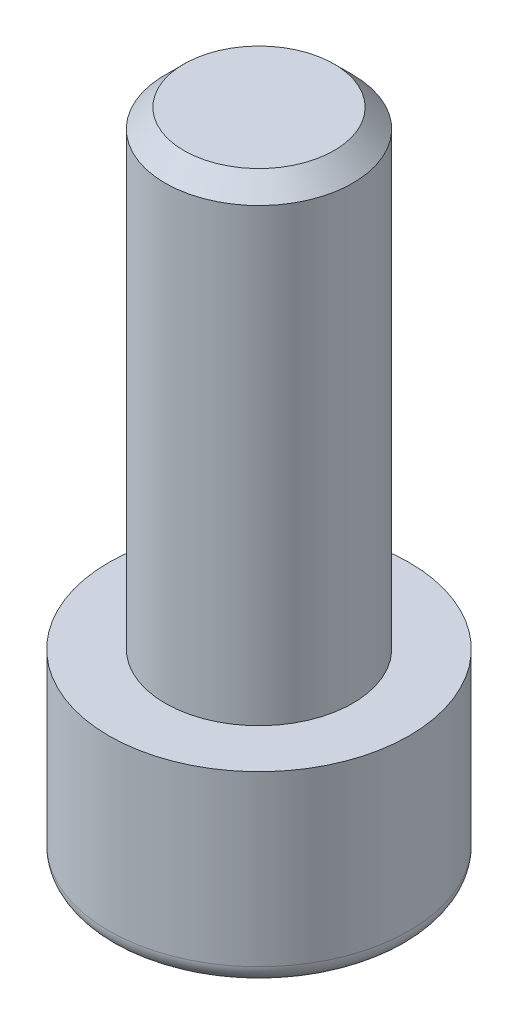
SolidWorks part; units mm, degrees
ref_plane "Plan de face" through (0, 0, 0) normal (0, 0, 1) x (1, 0, 0)
ref_plane "Plan de dessus" through (0, 0, 0) normal (0, 1, 0) x (1, 0, 0)
ref_plane "Plan de droite" through (0, 0, 0) normal (1, 0, 0) x (0, 0, -1)
sketch "Esquisse1" plane through (0, 0, 0) normal (0, 1, 0) x (1, 0, 0)
  circle A0 centre (0, 0) radius 5
  dimension "D1" = 10
extrude "Extrusion1" add sketch "Esquisse1" along normal blind 25
chamfer "Chanfrein1" distance 1 angle 45 1 edges at (0, 25, 5)
sketch "Esquisse2" plane through (0, 0, 0) normal (0, -1, 0) x (1, 0, 0)
  circle A0 centre (0, 0) radius 8
  dimension "D1" = 16
extrude "Extrusion2" add sketch "Esquisse2" along normal blind 10
fillet "Congé1" radius 1 1 edges at (0, -10, -8)
sketch "Esquisse3" plane through (0, -10, 0) normal (0, -1, 0) x (1, 0, 0)
  line L0 (-4, 2.3056) -> (0, 4.6)
  line L1 (0, 4.6) -> (4, 2.3056)
  line L2 (4, 2.3056) -> (4, -2.3056)
  line L3 (4, -2.3056) -> (0, -4.6)
  line L4 (0, -4.6) -> (-4, -2.3056)
  line L5 (-4, -2.3056) -> (-4, 2.3056)
  line L6 (0, 4.6) -> (0, -4.6) construction
  line L7 (-4, 0) -> (4, 0) construction
  dimension "D1" = 8
  dimension "D2" = 9.2
extrude "Enlèv. mat.-Extru.1" cut sketch "Esquisse3" against normal blind 6
